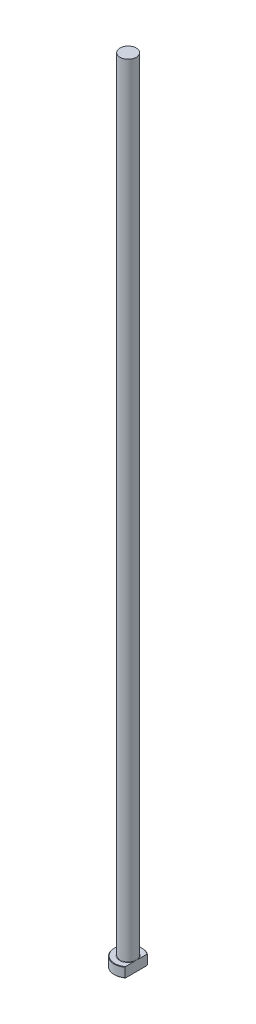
SolidWorks part; units mm, degrees
ref_plane "Front Plane" through (0, 0, 0) normal (0, 0, 1) x (1, 0, 0)
ref_plane "Top Plane" through (0, 0, 0) normal (0, 1, 0) x (1, 0, 0)
ref_plane "Right Plane" through (0, 0, 0) normal (1, 0, 0) x (0, 0, -1)
sketch "Sketch1" plane through (0, 0, 0) normal (0, 0, 1) x (1, 0, 0)
  line L0 (0, 259.9588) -> (0, -15.1925) construction
  line L1 (0, 0) -> (-7, 0)
  line L2 (-7, 0) -> (-7, 5)
  line L3 (-7, 5) -> (-4.1, 5)
  line L4 (-4.1, 5) -> (-4.1, 400)
  line L5 (-4.1, 400) -> (0, 400)
  line L6 (0, 400) -> (0, 0)
  dimension "L" = 400
  dimension "H" = 14
  dimension "T" = 5
  dimension "D" = 8.2
revolve "Revolve1" add sketch "Sketch1" angle 360 about L0
chamfer "Chamfer1" distance 0.2 angle 45 2 edges at (0, 5, 7) (0, 0, 7)
fillet "Fillet1" radius 0.2 1 edges at (0, 5, 4.1)
sketch "Sketch2" plane through (0, 0, 0) normal (0, 1, 0) x (1, 0, 0)
  line L0 (4.1, 5.6736) -> (4.1, -5.6736)
  circle A0 centre (0, 0) radius 7 construction
  arc A1 (4.1, -5.6736) -> (4.1, 5.6736) centre (0, 0) ccw
  circle A2 centre (0, 0) radius 4.1 construction
extrude "KEY" cut sketch "Sketch2" along normal through all
